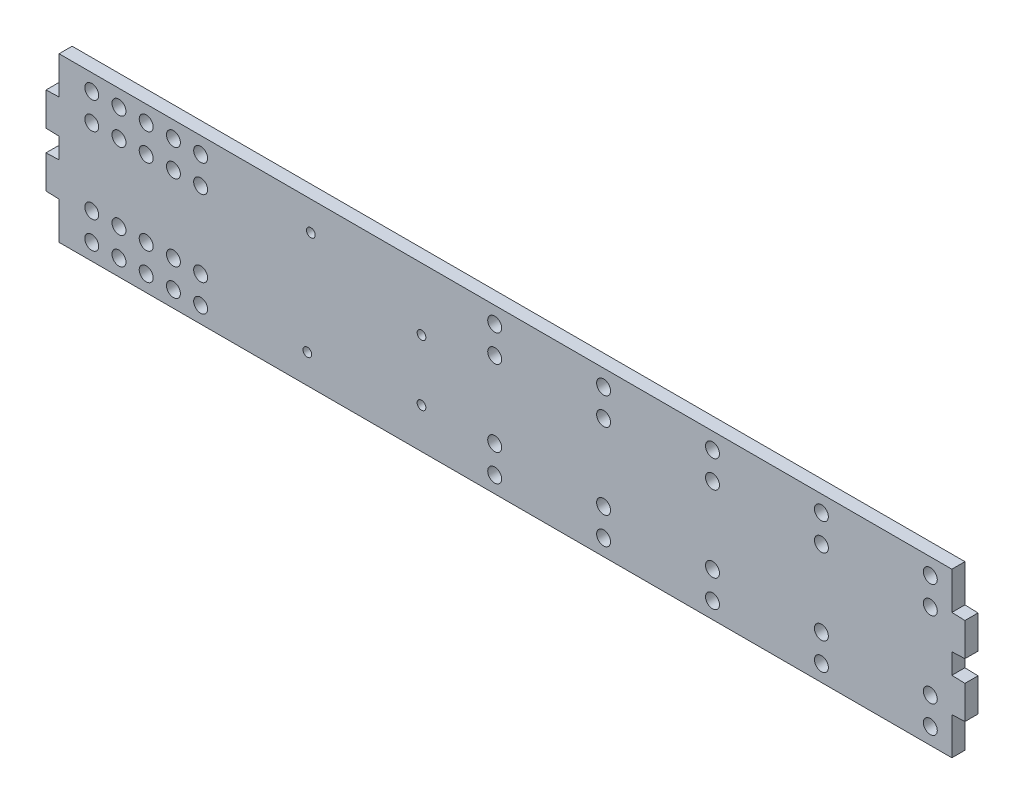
SolidWorks part; units mm, degrees
ref_plane "Front" through (0, 0, 0) normal (0, 0, 1) x (1, 0, 0)
ref_plane "Top" through (0, 0, 0) normal (0, 1, 0) x (1, 0, 0)
ref_plane "Right" through (0, 0, 0) normal (1, 0, 0) x (0, 0, -1)
sketch "Sketch1" plane through (0, 0, 0) normal (0, 0, 1) x (1, 0, 0)
  line L0 (-205, 140.9) -> (-205, -146.5) construction
  line L1 (-205, 34.7) -> (204.9, 34.7)
  line L2 (-205, 34.7) -> (-205, -40.3)
  line L3 (-205, -40.3) -> (204.9, -40.3)
  line L4 (204.9, 34.7) -> (204.9, -40.3)
  line L5 (204.9, 140.9) -> (204.9, -146.5) construction
  point P8 (-211, 34.7)
  point P9 (-211, -40.3)
  point P10 (0, 0)
  point P12 (0, 0)
extrude "Boss-Extrude1" add sketch "Sketch1" along normal mid plane 6
sketch "Sketch2" plane through (0, 0, 3) normal (0, 0, 1) x (1, 0, 0)
  line L0 (-205, 34.7) -> (-205, -40.3) construction
  line L1 (204.9, -2.8) -> (-205, -2.8) construction
  line L2 (204.9, -40.3) -> (204.9, 34.7) construction
  line L3 (-0.05, -40.3) -> (-0.05, 34.7) construction
  line L4 (-205, -40.3) -> (204.9, -40.3) construction
  line L5 (204.9, 34.7) -> (-205, 34.7) construction
  line B0 (-211, 9.7) -> (-205, 9.7) construction
  line B1 (-205, 1.8905) -> (-205, 17.5095)
  line B2 (-205, 17.5095) -> (-211, 17.3)
  line B3 (-211, 17.3) -> (-211, 2.1)
  line B4 (-205, 1.8905) -> (-211, 2.1)
  line B5 (-211, -15.3) -> (-205, -15.3) construction
  line B6 (-205, -23.1095) -> (-205, -7.4905)
  line B7 (-205, -7.4905) -> (-211, -7.7)
  line B8 (-211, -7.7) -> (-211, -22.9)
  line B9 (-205, -23.1095) -> (-211, -22.9)
  line B10 (204.9, 1.8905) -> (204.9, 17.5095)
  line B11 (204.9, 17.5095) -> (210.9, 17.3)
  line B12 (210.9, 17.3) -> (210.9, 2.1)
  line B13 (204.9, 1.8905) -> (210.9, 2.1)
  line B14 (204.9, -23.1095) -> (204.9, -7.4905)
  line B15 (204.9, -7.4905) -> (210.9, -7.7)
  line B16 (210.9, -7.7) -> (210.9, -22.9)
  line B17 (204.9, -23.1095) -> (210.9, -22.9)
  dimension "D1" = 25
sketch_block_instance "Block-laser-cut-tab-15x6-1"
sketch_block "Block-laser-cut-tab-15x6" parameters "D1"=6, "D2"=15.2, "D3"=88
sketch_block_instance "Block-laser-cut-tab-15x6-2"
sketch_block_instance "Block-laser-cut-tab-15x6-4"
sketch_block_instance "Block-laser-cut-tab-15x6-5"
extrude "Boss-Extrude2" add sketch "Sketch2" against normal up to surface (6 mm away)
sketch "Arduino outline" plane through (0, 0, 3) normal (0, 0, 1) x (1, 0, 0)
  line L0 (204.9, -2.8) -> (-205, -2.8) construction
  line L1 (204.9, -7.4905) -> (204.9, 1.8905) construction
  line L2 (-205, 1.8905) -> (-205, -7.4905) construction
  line L3 (-205, -23.1095) -> (-205, -40.3) construction
  point P6 (0, 0)
  line B0 (-36.4, 8.15) -> (-36.4, -23.85)
  line B1 (-39, -29.45) -> (-104, -29.45)
  line B2 (-39, -29.45) -> (-39, -26.45)
  line B3 (-40, 23.85) -> (-104, 23.85)
  line B4 (-105, -28.45) -> (-105, 22.85)
  line B5 (-39, -29.45) -> (-105, 23.85) construction
  line B6 (-39, 23.85) -> (-105, -29.45) construction
  line B7 (-36.4, -23.85) -> (-39, -26.45)
  line B8 (-36.4, 8.15) -> (-39, 10.75)
  line B9 (-39, 10.75) -> (-39, 22.85)
  line B10 (-104, -29.45) -> (-105, -28.45)
  line B11 (-91, 21.35) -> (-91, -26.95) construction
  circle B12 centre (-89.4, 21.35) radius 1.6
  circle B13 centre (-91, -26.95) radius 1.6
  circle B14 centre (-38.6, -21.85) radius 1.6
  circle B15 centre (-38.6, 6.05) radius 1.6
  dimension "D1" = 100
sketch_block_instance "Block-Arduino-outline-1"
sketch_block "Block-Arduino-outline" parameters "D13"=3.2, "D1"=66, "D2"=53.3, "D3"=68.6, "D4"=32, "D5"=45, "D6"=3, "D14"=2.5, "D15"=27.9, "D16"=5.1, "D17"=50.8, "D18"=14, "D19"=2.5
sketch "Sketch4" plane through (0, 0, 3) normal (0, 0, 1) x (1, 0, 0)
  circle A0 centre (-91, -26.95) radius 2
  circle A1 centre (-89.4, 21.35) radius 2
  circle A2 centre (-38.6, 6.05) radius 2
  circle A3 centre (-38.6, -21.85) radius 2
  circle A4 centre (-91, -26.95) radius 1.6 construction
  circle A5 centre (-89.4, 21.35) radius 1.6 construction
  circle A6 centre (-38.6, 6.05) radius 1.6 construction
  circle A7 centre (-38.6, -21.85) radius 1.6 construction
  dimension "D1" = 4
extrude "threaded insert holes" cut sketch "Sketch4" against normal up to next
sketch "Sketch5" plane through (0, 0, 3) normal (0, 0, 1) x (1, 0, 0)
  line L0 (-205, 34.7) -> (-205, 17.5095) construction
  line L1 (204.9, 34.7) -> (-205, 34.7) construction
  line L2 (-205, -2.8) -> (204.9, -2.8) construction
  circle A0 centre (-190, 27.2) radius 3.2
  circle A1 centre (-177.5, 27.2) radius 3.2
  circle A2 centre (-165, 27.2) radius 3.2
  circle A3 centre (-152.5, 27.2) radius 3.2
  circle A4 centre (-140, 27.2) radius 3.2
  circle A5 centre (-177.5, 14.7) radius 3.2
  circle A6 centre (-165, 14.7) radius 3.2
  circle A7 centre (-152.5, 14.7) radius 3.2
  circle A8 centre (-140, 14.7) radius 3.2
  circle A9 centre (-190, 14.7) radius 3.2
  circle A10 centre (-5, 27.2) radius 3.2
  circle A11 centre (45, 27.2) radius 3.2
  circle A12 centre (95, 27.2) radius 3.2
  circle A13 centre (145, 27.2) radius 3.2
  circle A14 centre (45, 14.7) radius 3.2
  circle A15 centre (95, 14.7) radius 3.2
  circle A16 centre (145, 14.7) radius 3.2
  circle A17 centre (-5, 14.7) radius 3.2
  circle A18 centre (-5, -20.3) radius 3.2
  circle A19 centre (145, -20.3) radius 3.2
  circle A20 centre (95, -20.3) radius 3.2
  circle A21 centre (45, -20.3) radius 3.2
  circle A22 centre (145, -32.8) radius 3.2
  circle A23 centre (95, -32.8) radius 3.2
  circle A24 centre (45, -32.8) radius 3.2
  circle A25 centre (-5, -32.8) radius 3.2
  circle A26 centre (-190, -20.3) radius 3.2
  circle A27 centre (-140, -20.3) radius 3.2
  circle A28 centre (-152.5, -20.3) radius 3.2
  circle A29 centre (-165, -20.3) radius 3.2
  circle A30 centre (-177.5, -20.3) radius 3.2
  circle A31 centre (-140, -32.8) radius 3.2
  circle A32 centre (-152.5, -32.8) radius 3.2
  circle A33 centre (-165, -32.8) radius 3.2
  circle A34 centre (-177.5, -32.8) radius 3.2
  circle A35 centre (-190, -32.8) radius 3.2
  circle A36 centre (195, 27.2) radius 3.2
  circle A37 centre (195, 14.7) radius 3.2
  circle A38 centre (195, -20.3) radius 3.2
  circle A39 centre (195, -32.8) radius 3.2
  dimension "D1" = 6.4
  dimension "D6" = 200
  dimension "D2" = 15
  dimension "D3" = 7.5
  dimension "D4" = 5
  dimension "D5" = 2
  dimension "D7" = 5
  dimension "D8" = 2
extrude "wire anchor holes" cut sketch "Sketch5" against normal up to next (6 mm away)
